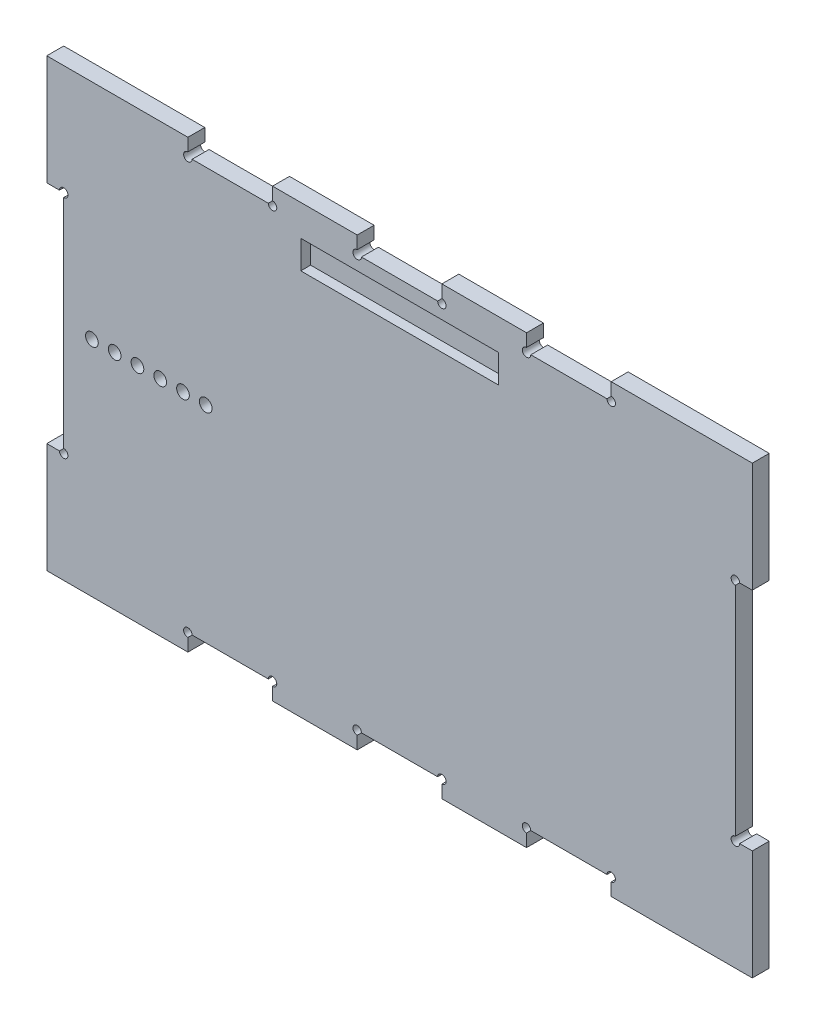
SolidWorks part; units mm, degrees
ref_plane "Plan de face" through (0, 0, 0) normal (0, 0, 1) x (1, 0, 0)
ref_plane "Plan de dessus" through (0, 0, 0) normal (0, 1, 0) x (1, 0, 0)
ref_plane "Plan de droite" through (0, 0, 0) normal (1, 0, 0) x (0, 0, -1)
sketch "Esquisse2" plane through (0, 0, 0) normal (0, 0, 1) x (1, 0, 0)
  line L0 (-97.7519, 36.2844) -> (-97.7519, 0)
  line L1 (-97.7519, 0) -> (-91.7519, 0)
  line L2 (-91.7519, 0) -> (-91.7519, -80)
  line L3 (-91.7519, -80) -> (-97.7519, -80)
  line L4 (-97.7519, -80) -> (-97.7519, -119)
  line L5 (-97.7519, -119) -> (-47.7519, -119)
  line L6 (-47.7519, -119) -> (-47.7519, -113)
  line L7 (-47.7519, -113) -> (-17.7519, -113)
  line L8 (-17.7519, -113) -> (-17.7519, -119)
  line L9 (-17.7519, -119) -> (12.2481, -119)
  line L10 (12.2481, -119) -> (12.2481, -113)
  line L11 (12.2481, -113) -> (42.2481, -113)
  line L12 (42.2481, -113) -> (42.2481, -119)
  line L13 (42.2481, -119) -> (72.2481, -119)
  line L14 (72.2481, -119) -> (72.2481, -113)
  line L15 (72.2481, -113) -> (102.2481, -113)
  line L16 (102.2481, -113) -> (102.2481, -119)
  line L17 (102.2481, -119) -> (152.2481, -119)
  line L18 (152.2481, -119) -> (152.2481, -80)
  line L19 (152.2481, -80) -> (146.2481, -80)
  line L20 (146.2481, -80) -> (146.2481, 0)
  line L21 (146.2481, 0) -> (152.2481, 0)
  line L22 (152.2481, 0) -> (152.2481, 39)
  line L23 (152.2481, 39) -> (102.2481, 39)
  line L24 (102.2481, 39) -> (102.2481, 33)
  line L25 (102.2481, 33) -> (72.2481, 33)
  line L26 (72.2481, 33) -> (72.2481, 39)
  line L27 (72.2481, 39) -> (42.2481, 39)
  line L28 (42.2481, 39) -> (42.2481, 33)
  line L29 (42.2481, 33) -> (12.2481, 33)
  line L30 (12.2481, 33) -> (12.2481, 39)
  line L31 (12.2481, 39) -> (-17.7519, 39)
  line L32 (-17.7519, 39) -> (-17.7519, 33)
  line L33 (-17.7519, 33) -> (-47.7519, 33)
  line L34 (-47.7519, 33) -> (-47.7519, 39)
  line L35 (-47.7519, 39) -> (-97.7519, 39)
  line L36 (-97.7519, 39) -> (-97.7519, 36.2844)
  dimension "D1" = 158
  dimension "D2" = 6
  dimension "D3" = 6
  dimension "D4" = 6
  dimension "D5" = 6
  dimension "D6" = 250
  dimension "D7" = 30
  dimension "D8" = 30
  dimension "D9" = 30
  dimension "D10" = 30
  dimension "D11" = 30
  dimension "D12" = 30
  dimension "D13" = 80
  dimension "D14" = 80
  dimension "D15" = 30
  dimension "D16" = 30
  dimension "D17" = 30
  dimension "D18" = 30
  dimension "D19" = 50
  dimension "D20" = 50
  dimension "D21" = 39
extrude "Boss.-Extru.1" add sketch "Esquisse2" along normal blind 6
sketch "Esquisse3" plane through (0, 0, 6) normal (0, 0, 1) x (1, 0, 0)
  circle A0 centre (-47.7519, 33) radius 1.5
  circle A1 centre (-17.7519, 33) radius 1.5
  circle A2 centre (12.2481, 33) radius 1.5
  circle A3 centre (42.2481, 33) radius 1.5
  circle A4 centre (72.2481, 33) radius 1.5
  circle A5 centre (102.2481, 33) radius 1.5
  circle A6 centre (146.2481, 0) radius 1.5
  circle A7 centre (146.2481, -80) radius 1.5
  circle A8 centre (102.2481, -113) radius 1.5
  circle A9 centre (72.2481, -113) radius 1.5
  circle A10 centre (42.2481, -113) radius 1.5
  circle A11 centre (12.2481, -113) radius 1.5
  circle A12 centre (-17.7519, -113) radius 1.5
  circle A13 centre (-47.7519, -113) radius 1.5
  circle A14 centre (-91.7519, -80) radius 1.5
  circle A15 centre (-91.7519, 0) radius 1.5
extrude "Enlèv. mat.-Extru.1" cut sketch "Esquisse3" against normal through all
sketch "Esquisse5" plane through (0, 0, 6) normal (0, 0, 1) x (1, 0, 0)
  line L0 (152.2481, 0) -> (152.2481, 39) construction
  line L1 (-7.7519, 28) -> (62.2481, 28)
  line L2 (-7.7519, 28) -> (-7.7519, 18)
  line L3 (-7.7519, 18) -> (62.2481, 18)
  line L4 (62.2481, 28) -> (62.2481, 18)
  line L5 (-97.7519, 39) -> (-97.7519, 0) construction
  line L7 (100.7481, 33) -> (73.7481, 33) construction
  dimension "D1" = 90
  dimension "D2" = 90
  dimension "D3" = 10
  dimension "D4" = 5
extrude "Enlèv. mat.-Extru.2" cut sketch "Esquisse5" against normal blind 3.5
sketch "Esquisse7" plane through (0, 0, 6) normal (0, 0, 1) x (1, 0, 0)
  line L1 (-91.7519, -1.5) -> (-91.7519, -78.5) construction
  line L2 (-97.7519, -119) -> (-47.7519, -119) construction
  circle B0 centre (-81.7519, -40) radius 2.25
  circle B1 centre (-65.6219, -40) radius 2.25
  circle B2 centre (-73.6869, -40) radius 2.25
  circle B3 centre (-57.5569, -40) radius 2.25
  circle B4 centre (-49.4919, -40) radius 2.25
  circle B5 centre (-41.4269, -40) radius 2.25
  dimension "D1" = 10
  dimension "D2" = 79
sketch_block_instance "Bloc1-1"
sketch_block "Bloc1"
extrude "Enlèv. mat.-Extru.3" cut sketch "Esquisse7" against normal blind 4
